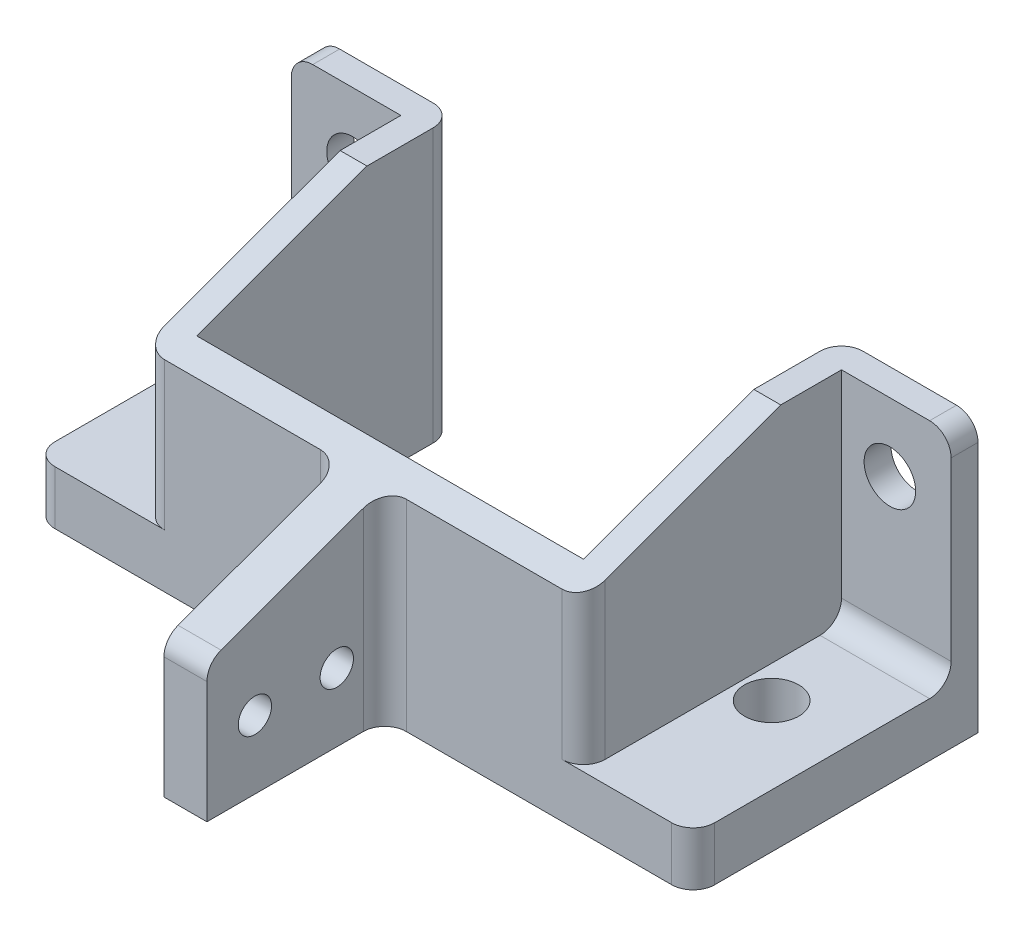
SolidWorks part; units mm, degrees
ref_plane "Front" through (0, 0, 0) normal (0, 0, 1) x (1, 0, 0)
ref_plane "Top" through (0, 0, 0) normal (0, 1, 0) x (1, 0, 0)
ref_plane "Right" through (0, 0, 0) normal (1, 0, 0) x (0, 0, -1)
sketch "Sketch1" plane through (0, 0, 0) normal (0, 1, 0) x (1, 0, 0)
  line L2 (-18, 24) -> (-18, 0)
  line L3 (-18, 0) -> (18, 0)
  line L4 (18, 24) -> (18, 0)
  line L5 (-18, 24) -> (-30.7, 24)
  line L6 (18, 24) -> (30.7, 24)
  point P4 (0, 0)
  dimension "D1" = 24
  dimension "D2" = 36
  dimension "D3" = 12.7
extrude "Extrude-Thin1" add sketch "Sketch1" along normal blind 25.4 thin
sketch "Sketch2" plane through (0, 0, 0) normal (0, 1, 0) x (1, 0, 0)
  line L0 (0, 0) -> (0, -19.05)
  dimension "D1" = 19.05
extrude "Extrude-Thin2" add sketch "Sketch2" along normal up to surface (25.4 mm away) thin
sketch "Sketch3" plane through (0, 0, 0) normal (0, 1, 0) x (1, 0, 0)
  line L5 (-30.7, 21.5) -> (-20.5, 21.5)
  line L6 (-30.7, 21.5) -> (-30.7, -2.5)
  line L7 (-30.7, -2.5) -> (-20.5, -2.5)
  line L8 (-20.5, 21.5) -> (-20.5, -2.5)
  line L9 (30.7, 21.5) -> (20.5, 21.5)
  line L10 (30.7, 21.5) -> (30.7, -2.5)
  line L11 (30.7, -2.5) -> (20.5, -2.5)
  line L12 (20.5, 21.5) -> (20.5, -2.5)
extrude "Boss-Extrude1" add sketch "Sketch3" along normal blind 5
hole_wizard "#8 (0.199) Diameter Hole1" positions "Sketch18" profile "Sketch5" hole size "#8" standard "ANSI Inch"
sketch "Sketch18" plane through (0, 0, 0) normal (0, -1, 0) x (-1, 0, 0)
  line L0 (-23.5, 12) -> (23.5, 12) construction
  line L2 (0, 0) -> (0, 12) construction
  point P0 (-23.5, 12)
  point P2 (23.5, 12)
  point P18 (-23.5, 11.55)
  dimension "D1" = 47
  dimension "D2" = 12
sketch "Sketch5" plane through (23.5, 0, -12) normal (1, 0, 0) x (0, 0, -1)
  line L0 (0, 0) -> (0, 25.4)
  line L1 (0, 25.4) -> (2.5273, 25.4)
  line L2 (2.5273, 25.4) -> (2.5273, 0)
  line L5 (2.5273, 0) -> (0, 0)
  line L11 (0, -6.35) -> (0, 107.95) construction
  dimension "Thru Hole Dia." = 5.0546
  dimension "Thru Hole Depth" = 25.4
hole_wizard "M2.5 Clearance Hole1" positions "Sketch16" profile "Sketch8" hole size "M2.5" standard "ANSI Metric"
sketch "Sketch16" plane through (-2, 0, 0) normal (-1, 0, 0) x (0, 0, 1)
  line L0 (6.965, 6.35) -> (14.585, 6.35)
  line L4 (10.775, 6.35) -> (10.775, 0) construction
  line L5 (2.5, 0) -> (19.05, 0) construction
  dimension "D1" = 7.62
  dimension "D2" = 6.35
sketch "Sketch8" plane through (-2, 6.35, 6.965) normal (0, 1, 0) x (0, 0, 1)
  line L0 (0, 0) -> (0, 32.7)
  line L1 (0, 32.7) -> (1.55, 32.7)
  line L2 (1.55, 32.7) -> (1.55, 0)
  line L5 (1.55, 0) -> (0, 0)
  line L11 (0, -6.35) -> (0, 107.95) construction
  dimension "Thru Hole Dia." = 3.1
  dimension "Thru Hole Depth" = 32.7
chamfer "Chamfer1" distance 12.7 angle 70 1 edges at (0, 25.4, 19.05)
hole_wizard "M4 Clearance Hole1" positions "Sketch17" profile "Sketch14" hole size "M4" standard "ANSI Metric"
sketch "Sketch17" plane through (0, 0, -21.5) normal (0, 0, 1) x (1, 0, 0)
  line L0 (-25, 19.05) -> (25, 19.05)
  line L2 (-2, 0) -> (-30.7, 0) construction
  point P4 (0, 19.05)
  dimension "D1" = 50
  dimension "D2" = 19.05
sketch "Sketch14" plane through (-25, 19.05, -21.5) normal (1, 0, 0) x (0, -1, 0)
  line L0 (0, 0) -> (0, 2.5)
  line L1 (0, 2.5) -> (2.4, 2.5)
  line L2 (2.4, 2.5) -> (2.4, 0)
  line L5 (2.4, 0) -> (0, 0)
  line L11 (0, -6.35) -> (0, 107.95) construction
  dimension "Thru Hole Dia." = 4.8
  dimension "Thru Hole Depth" = 2.5
fillet "Fillet2" radius 2 13 edges at (20.5, 11.8619, 2.5) (0, 12.7, 19.05) (-20.5, 11.8619, 2.5) (-18, 12.7, -24) (18, 12.7, -24) (30.7, 25.4, -22.75) (-2, 9.3619, 2.5) (2, 9.3619, 2.5) (-30.7, 2.5, 2.5) (-25.6, 5, -21.5) (30.7, 2.5, 2.5) (25.6, 5, -21.5) (-30.7, 25.4, -22.75)
